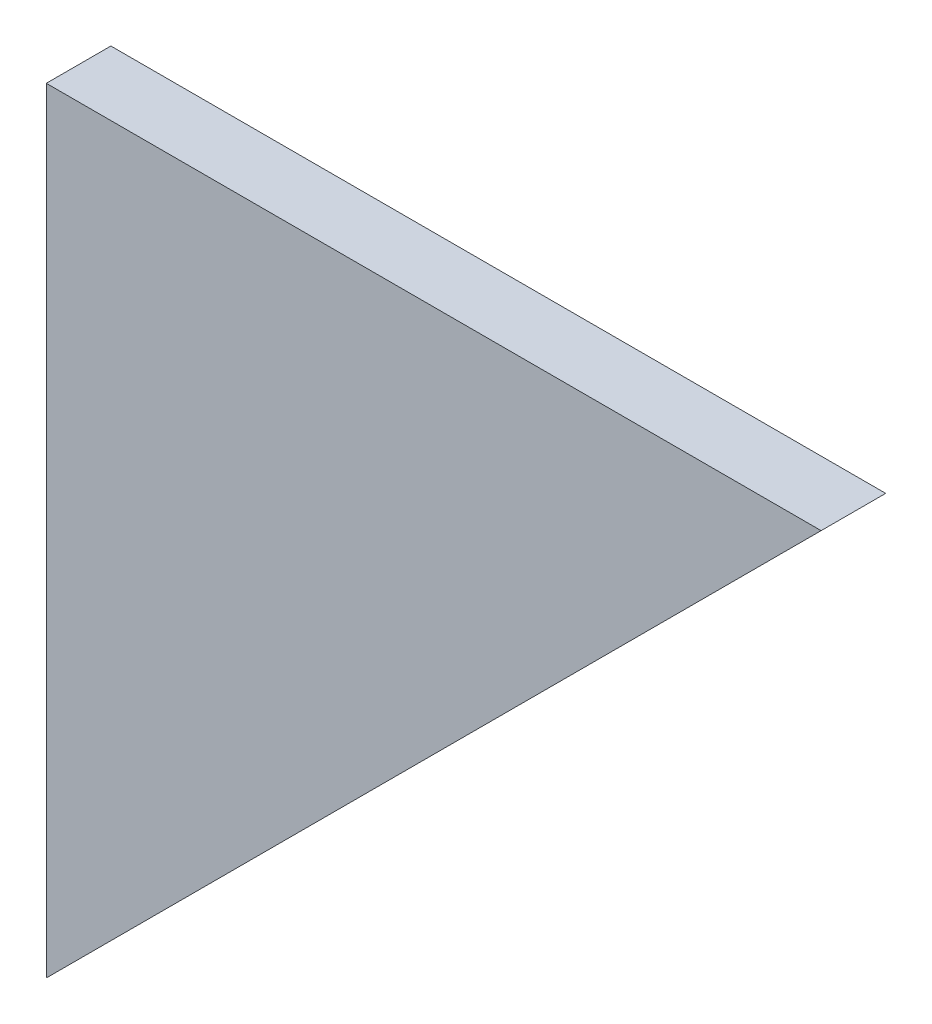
SolidWorks part; units mm, degrees
ref_plane "Front Plane" through (0, 0, 0) normal (0, 0, 1) x (1, 0, 0)
ref_plane "Top Plane" through (0, 0, 0) normal (0, 1, 0) x (1, 0, 0)
ref_plane "Right Plane" through (0, 0, 0) normal (1, 0, 0) x (0, 0, -1)
sketch "Sketch3" plane through (0, 0, 0) normal (0, 0, 1) x (1, 0, 0)
  line L1 (-38.1, -38.1) -> (38.1, -38.1)
  line L2 (-38.1, -38.1) -> (-38.1, 38.1)
  line L3 (-38.1, 38.1) -> (38.1, 38.1)
  line L4 (38.1, -38.1) -> (38.1, 38.1)
  line L5 (-38.1, -38.1) -> (38.1, 38.1) construction
  line L6 (-38.1, 38.1) -> (38.1, -38.1) construction
  point P0 (0, 0)
  dimension "D1" = 76.2
  dimension "D2" = 76.2
extrude "Extrude1" add sketch "Sketch3" along normal mid plane 6.35
sketch "Sketch4" plane through (0, 0, 3.175) normal (0, 0, 1) x (1, 0, 0)
  line L0 (-38.1, -38.1) -> (38.1, 38.1)
  line L4 (38.1, -38.1) -> (38.1, 38.1)
  line L5 (38.1, 38.1) -> (-38.1, 38.1)
  line L6 (-38.1, 38.1) -> (-38.1, -38.1)
  line L7 (-38.1, -38.1) -> (38.1, -38.1)
  line L8 (38.1, -38.1) -> (38.1, 38.1)
  line L9 (38.1, 38.1) -> (-38.1, 38.1)
  line L10 (-38.1, 38.1) -> (-38.1, -38.1)
  line L11 (-38.1, -38.1) -> (38.1, -38.1)
  dimension "D1" = 0
extrude "Extrude2" cut sketch "Sketch4" against normal through all contours L0 M8 M5
